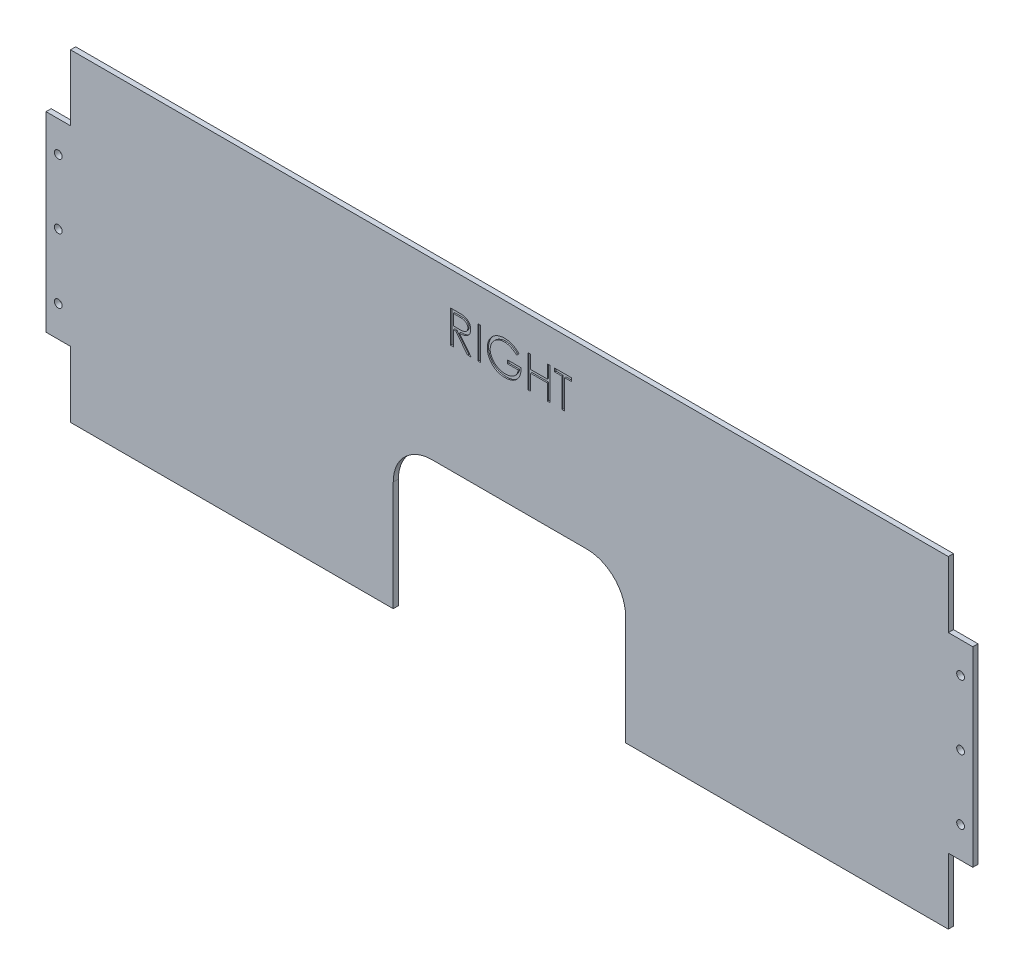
SolidWorks part; units mm, degrees
ref_plane "Plan de face" through (0, 0, 0) normal (0, 0, 1) x (1, 0, 0)
ref_plane "Plan de dessus" through (0, 0, 0) normal (0, 1, 0) x (1, 0, 0)
ref_plane "Plan de droite" through (0, 0, 0) normal (1, 0, 0) x (0, 0, -1)
sketch "Esquisse1" plane through (0, 0, 0) normal (0, 0, 1) x (1, 0, 0)
  line L0 (0, -125) -> (0, 125) construction
  line L1 (340, 125) -> (-340, 125)
  line L2 (-340, 125) -> (-340, 74)
  line L3 (-340, 74) -> (-359, 74)
  line L4 (-359, 74) -> (-359, -74)
  line L5 (-359, -74) -> (-340, -74)
  line L6 (-340, -74) -> (-340, -125)
  line L7 (-340, -125) -> (340, -125)
  line L8 (340, -74) -> (340, -125)
  line L9 (359, -74) -> (340, -74)
  line L10 (359, 74) -> (359, -74)
  line L11 (340, 74) -> (359, 74)
  line L12 (340, 125) -> (340, 74)
  point P4 (0, 0)
  point P7 (-359, 0)
  dimension "D1" = 250
  dimension "D2" = 19
  dimension "D3" = 148
  dimension "D4" = 340
extrude "Boss.-Extru.1" add sketch "Esquisse1" along normal blind 4
sketch "Esquisse2" plane through (0, 0, 4) normal (0, 0, 1) x (1, 0, 0)
  line L0 (-349.5, 74) -> (-349.5, -74) construction
  line L1 (-340, 74) -> (-359, 74) construction
  line L2 (-359, -74) -> (-340, -74) construction
  line L3 (0, 125) -> (0, -125) construction
  line L4 (340, 125) -> (-340, 125) construction
  line L5 (-340, -125) -> (340, -125) construction
  line L6 (349.5, 74) -> (349.5, -74) construction
  circle A0 centre (-349.5, 50) radius 3
  circle A1 centre (-349.5, -50) radius 3
  circle A2 centre (-349.5, 0) radius 3
  circle A3 centre (349.5, 0) radius 3
  circle A4 centre (349.5, -50) radius 3
  circle A5 centre (349.5, 50) radius 3
  dimension "D1" = 6
  dimension "D2" = 50
  dimension "D3" = 50
extrude "Enlèv. mat.-Extru.1" cut sketch "Esquisse2" against normal through all
sketch "Esquisse3" plane through (0, 0, 4) normal (0, 0, 1) x (1, 0, 0)
  line L0 (-340, -125) -> (340, -125) construction
  line L1 (-90, -125) -> (90, -125)
  line L2 (-90, -125) -> (-90, -10)
  line L3 (-90, -10) -> (90, -10)
  line L4 (90, -125) -> (90, -10)
  point P6 (0, -10)
  dimension "D1" = 180
  dimension "D2" = 115
extrude "Enlèv. mat.-Extru.2" cut sketch "Esquisse3" against normal through all
fillet "Congé1" radius 30 2 edges at (90, -10, 2) (-90, -10, 2)
sketch "Esquisse4" plane through (0, 0, 4) normal (0, 0, 1) x (1, 0, 0)
  line L0 (-359, 74) -> (359, 74) construction
  text T0 "RIGHT" font "Century Gothic" height 25
extrude "Enlèv. mat.-Extru.3" cut sketch "Esquisse4" against normal blind 1
